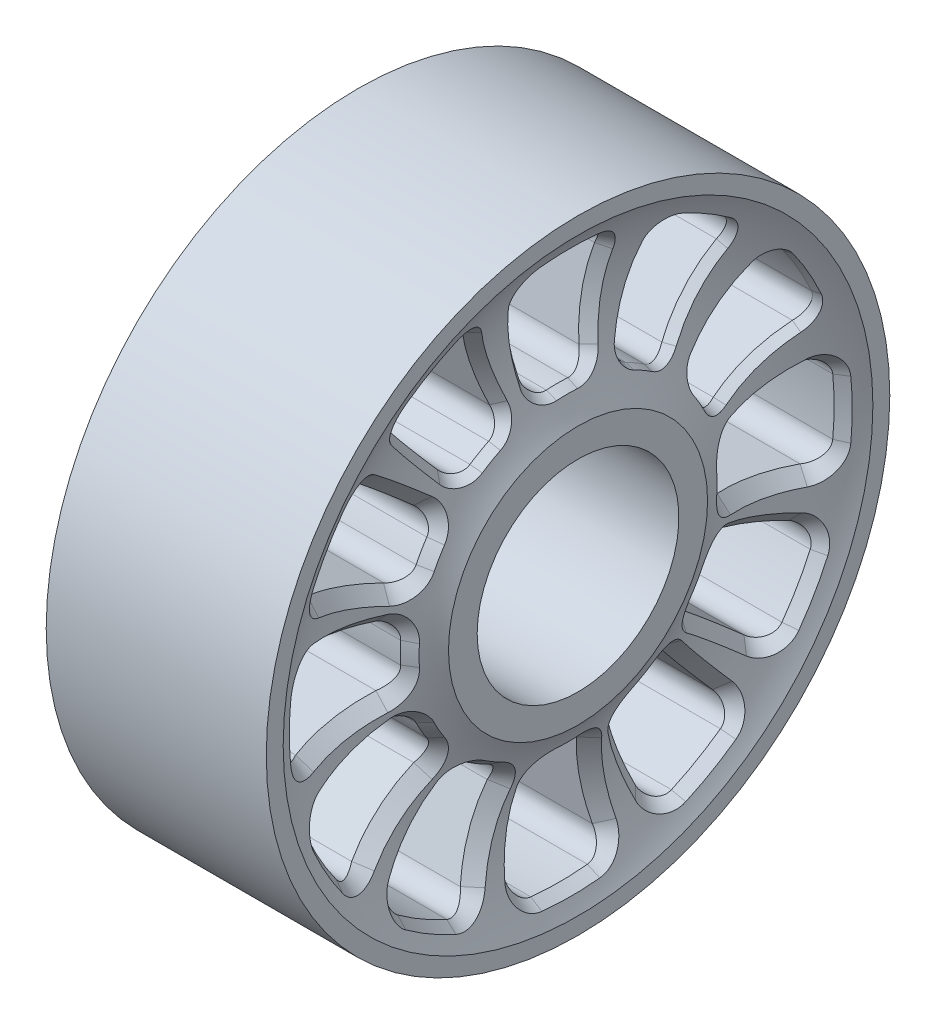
SolidWorks part; units mm, degrees
ref_plane "Alzado" through (0, 0, 0) normal (0, 0, 1) x (1, 0, 0)
ref_plane "Planta" through (0, 0, 0) normal (0, 1, 0) x (1, 0, 0)
ref_plane "Vista lateral" through (0, 0, 0) normal (1, 0, 0) x (0, 0, -1)
sketch "Croquis1" plane through (0, 0, 0) normal (0, 0, 1) x (1, 0, 0)
  line L0 (0, 0) -> (0, 11) construction
  line L1 (0, 11) -> (24, 11)
  line L2 (0, 11) -> (0, 16)
  line L3 (0, 16) -> (24, 16)
  line L4 (24, 11) -> (24, 16)
  line L5 (0, 34) -> (24, 34)
  line L6 (0, 34) -> (0, 31)
  line L7 (0, 31) -> (24, 31)
  line L8 (24, 34) -> (24, 31)
  line L9 (0, 16) -> (0, 31) construction
  line L10 (0, 0) -> (24, 0) construction
  line L11 (24, 0) -> (24, 11) construction
  dimension "D1" = 11
  dimension "D2" = 5
  dimension "D3" = 34
  dimension "D4" = 3
  dimension "D5" = 24
revolve "Revolución1" add sketch "Croquis1" angle 360 about L10
sketch "Croquis2" plane through (24, 0, 0) normal (1, 0, 0) x (0, 0, -1)
  line L0 (-5.2094, 29.5442) -> (-2.952, 16.7417)
  line L1 (2.952, 16.7417) -> (5.2094, 29.5442)
  line L2 (0, 30) -> (0, 31) construction
  line L3 (10.9274, 13.0228) -> (19.2836, 22.9813)
  line L4 (10.2606, 28.1908) -> (5.8143, 15.9748)
  line L5 (15.9748, 5.8143) -> (28.1908, 10.2606)
  line L6 (22.9813, 19.2836) -> (13.0228, 10.9274)
  line L7 (16.7417, -2.952) -> (29.5442, -5.2094)
  line L8 (29.5442, 5.2094) -> (16.7417, 2.952)
  line L9 (13.0228, -10.9274) -> (22.9813, -19.2836)
  line L10 (28.1908, -10.2606) -> (15.9748, -5.8143)
  line L11 (5.8143, -15.9748) -> (10.2606, -28.1908)
  line L12 (19.2836, -22.9813) -> (10.9274, -13.0228)
  line L13 (-2.952, -16.7417) -> (-5.2094, -29.5442)
  line L14 (5.2094, -29.5442) -> (2.952, -16.7417)
  line L15 (-10.9274, -13.0228) -> (-19.2836, -22.9813)
  line L16 (-10.2606, -28.1908) -> (-5.8143, -15.9748)
  line L17 (-15.9748, -5.8143) -> (-28.1908, -10.2606)
  line L18 (-22.9813, -19.2836) -> (-13.0228, -10.9274)
  line L19 (-16.7417, 2.952) -> (-29.5442, 5.2094)
  line L20 (-29.5442, -5.2094) -> (-16.7417, -2.952)
  line L21 (-13.0228, 10.9274) -> (-22.9813, 19.2836)
  line L22 (-28.1908, 10.2606) -> (-15.9748, 5.8143)
  line L23 (-5.8143, 15.9748) -> (-10.2606, 28.1908)
  line L24 (-19.2836, 22.9813) -> (-10.9274, 13.0228)
  arc A0 (-2.952, 16.7417) -> (2.952, 16.7417) centre (0, 0) cw
  arc A1 (5.2094, 29.5442) -> (-5.2094, 29.5442) centre (0, 0) ccw
  circle A2 centre (0, 0) radius 16 construction
  circle A3 centre (0, 0) radius 31 construction
  arc A4 (19.2836, 22.9813) -> (10.2606, 28.1908) centre (0, 0) ccw
  arc A5 (5.8143, 15.9748) -> (10.9274, 13.0228) centre (0, 0) cw
  arc A6 (28.1908, 10.2606) -> (22.9813, 19.2836) centre (0, 0) ccw
  arc A7 (13.0228, 10.9274) -> (15.9748, 5.8143) centre (0, 0) cw
  arc A8 (29.5442, -5.2094) -> (29.5442, 5.2094) centre (0, 0) ccw
  arc A9 (16.7417, 2.952) -> (16.7417, -2.952) centre (0, 0) cw
  arc A10 (22.9813, -19.2836) -> (28.1908, -10.2606) centre (0, 0) ccw
  arc A11 (15.9748, -5.8143) -> (13.0228, -10.9274) centre (0, 0) cw
  arc A12 (10.2606, -28.1908) -> (19.2836, -22.9813) centre (0, 0) ccw
  arc A13 (10.9274, -13.0228) -> (5.8143, -15.9748) centre (0, 0) cw
  arc A14 (-5.2094, -29.5442) -> (5.2094, -29.5442) centre (0, 0) ccw
  arc A15 (2.952, -16.7417) -> (-2.952, -16.7417) centre (0, 0) cw
  arc A16 (-19.2836, -22.9813) -> (-10.2606, -28.1908) centre (0, 0) ccw
  arc A17 (-5.8143, -15.9748) -> (-10.9274, -13.0228) centre (0, 0) cw
  arc A18 (-28.1908, -10.2606) -> (-22.9813, -19.2836) centre (0, 0) ccw
  arc A19 (-13.0228, -10.9274) -> (-15.9748, -5.8143) centre (0, 0) cw
  arc A20 (-29.5442, 5.2094) -> (-29.5442, -5.2094) centre (0, 0) ccw
  arc A21 (-16.7417, -2.952) -> (-16.7417, 2.952) centre (0, 0) cw
  arc A22 (-22.9813, 19.2836) -> (-28.1908, 10.2606) centre (0, 0) ccw
  arc A23 (-15.9748, 5.8143) -> (-13.0228, 10.9274) centre (0, 0) cw
  arc A24 (-10.2606, 28.1908) -> (-19.2836, 22.9813) centre (0, 0) ccw
  arc A25 (-10.9274, 13.0228) -> (-5.8143, 15.9748) centre (0, 0) cw
  circle A26 centre (0, 0) radius 16
  circle A27 centre (0, 0) radius 31
  point P12 (0, 17)
  point P59 (0, 0)
  dimension "D1" = 1
  dimension "D2" = 1
  dimension "D3" = 20
  dimension "D4" = 12
extrude "Saliente-Extruir1" add sketch "Croquis2" against normal through all
sketch "Croquis3" plane through (0, 0, 0) normal (0, 0, 1) x (1, 0, 0)
  line L0 (0, 16.7417) -> (0, 29.5442) construction
  line L1 (0, 0) -> (24, 0) construction
  line L2 (24, -11) -> (24, 11) construction
  line L3 (12, 0) -> (12, 34) construction
  line L4 (24, 34) -> (0, 34) construction
  circle A0 centre (-15, 23.143) radius 17.5
  circle A1 centre (39, 23.143) radius 17.5
  point P5 (0, 23.143)
  dimension "D2" = 35
  dimension "D1" = 15
revolve "Cortar-Revolución1" cut sketch "Croquis3" angle 360 about L1
fillet "Redondeo1" radius 2 48 edges at (12, 19.2836, 22.9813) (12, -5.2094, -29.5442) (12, 5.2094, -29.5442) (12, 10.2606, -28.1908) (12, 19.2836, -22.9813) (12, 22.9813, -19.2836) (12, 28.1908, -10.2606) (12, 29.5442, -5.2094) (12, 29.5442, 5.2094) (12, 28.1908, 10.2606) (12, 22.9813, 19.2836) (12, 5.2094, 29.5442) (12, -5.2094, 29.5442) (12, -10.2606, 28.1908) (12, -19.2836, 22.9813) (12, -22.9813, 19.2836) (12, -28.1908, 10.2606) (12, -29.5442, 5.2094) (12, -29.5442, -5.2094) (12, -28.1908, -10.2606) (12, -22.9813, -19.2836) (12, -19.2836, -22.9813) (12, -10.2606, -28.1908) (12, -5.8143, -15.9748) (12, -10.9274, 13.0228) (12, -15.9748, 5.8143) (12, -16.7417, -2.952) (12, -13.0228, -10.9274) (12, -15.9748, -5.8143) (12, -16.7417, 2.952) (12, -13.0228, 10.9274) (12, -5.8143, 15.9748) (12, -2.952, 16.7417) (12, 2.952, 16.7417) (12, 5.8143, 15.9748) (12, 13.0228, 10.9274) (12, 16.7417, 2.952) (12, 15.9748, -5.8143) (12, 10.9274, -13.0228) (12, 2.952, -16.7417) (12, -10.9274, -13.0228) (12, -2.952, -16.7417) (12, 5.8143, -15.9748) (12, 13.0228, -10.9274) (12, 16.7417, -2.952) (12, 15.9748, 5.8143) (12, 10.9274, 13.0228) (12, 10.2606, 28.1908)
chamfer "Chaflán1" distance 1 angle 30 192 edges at (22.8993, 0, -30) (22.7481, -4.2266, -29.3304) (22.5914, 4.6066, -28.8611) (21.5022, -4.067, -23.0651) (21.5022, 4.067, -23.0651) (22.3957, -2.598, -17.4235) (22.459, 2.3827, -17.2658) (22.6136, 0, -17) (22.8993, -15, -25.9808) (22.7481, -18.3255, -23.2876) (22.5914, -10.4412, -27.2977) (21.5022, -15.0547, -17.9414) (21.5022, -8.0104, -22.0084) (22.3957, -10.9617, -13.7902) (22.459, -6.5694, -16.144) (22.6136, -8.5, -14.7224) (22.8993, -25.9808, -15) (22.7481, -27.5141, -11.0049) (22.5914, -22.6912, -18.42) (21.5022, -22.0084, -8.0104) (21.5022, -17.9414, -15.0547) (22.3957, -16.3882, -6.4618) (22.459, -13.7613, -10.6964) (22.6136, -14.7224, -8.5) (22.8993, -30, 0) (22.7481, -29.3304, 4.2266) (22.5914, -28.8611, -4.6066) (21.5022, -23.0651, 4.067) (21.5022, -23.0651, -4.067) (22.3957, -17.4235, 2.598) (22.459, -17.2658, -2.3827) (22.6136, -17, 0) (22.8993, -25.9808, 15) (22.7481, -23.2876, 18.3255) (22.5914, -27.2977, 10.4412) (21.5022, -17.9414, 15.0547) (21.5022, -22.0084, 8.0104) (22.3957, -13.7902, 10.9617) (22.459, -16.144, 6.5694) (22.6136, -14.7224, 8.5) (22.8993, -15, 25.9808) (22.7481, -11.0049, 27.5141) (22.5914, -18.42, 22.6912) (21.5022, -8.0104, 22.0084) (21.5022, -15.0547, 17.9414) (22.3957, -6.4618, 16.3882) (22.459, -10.6964, 13.7613) (22.6136, -8.5, 14.7224) (22.8993, 0, 30) (22.7481, 4.2266, 29.3304) (22.5914, -4.6066, 28.8611) (21.5022, 4.067, 23.0651) (21.5022, -4.067, 23.0651) (22.3957, 2.598, 17.4235) (22.459, -2.3827, 17.2658) (22.6136, 0, 17) (22.8993, 15, 25.9808) (22.7481, 18.3255, 23.2876) (22.5914, 10.4412, 27.2977) (21.5022, 15.0547, 17.9414) (21.5022, 8.0104, 22.0084) (22.3957, 10.9617, 13.7902) (22.459, 6.5694, 16.144) (22.6136, 8.5, 14.7224) (22.5914, 22.6912, 18.42) (22.8993, 25.9808, 15) (21.5022, 17.9414, 15.0547) (22.7481, 27.5141, 11.0049) (22.459, 13.7613, 10.6964) (21.5022, 22.0084, 8.0104) (22.6136, 14.7224, 8.5) (22.3957, 16.3882, 6.4618) (22.5914, 28.8611, 4.6066) (22.8993, 30, 0) (21.5022, 23.0651, 4.067) (22.7481, 29.3304, -4.2266) (22.459, 17.2658, 2.3827) (21.5022, 23.0651, -4.067) (22.6136, 17, 0) (22.3957, 17.4235, -2.598) (21.5022, 22.0084, -8.0104) (22.5914, 27.2977, -10.4412) (22.459, 16.144, -6.5694) (22.8993, 25.9808, -15) (22.6136, 14.7224, -8.5) (22.7481, 23.2876, -18.3255) (22.3957, 13.7902, -10.9617) (21.5022, 17.9414, -15.0547) (21.5022, 15.0547, -17.9414) (22.5914, 18.42, -22.6912) (22.459, 10.6964, -13.7613) (22.8993, 15, -25.9808) (22.6136, 8.5, -14.7224) (22.7481, 11.0049, -27.5141) (22.3957, 6.4618, -16.3882) (21.5022, 8.0104, -22.0084) (1.1007, 25.9808, -15) (1.2519, 27.5141, -11.0049) (1.4086, 22.6912, -18.42) (2.4978, 22.0084, -8.0104) (2.4978, 17.9414, -15.0547) (1.6043, 16.3882, -6.4618) (1.541, 13.7613, -10.6964) (1.3864, 14.7224, -8.5) (1.1007, 15, -25.9808) (1.2519, 18.3255, -23.2876) (1.4086, 10.4412, -27.2977) (2.4978, 15.0547, -17.9414) (2.4978, 8.0104, -22.0084) (1.6043, 10.9617, -13.7902) (1.541, 6.5694, -16.144) (1.3864, 8.5, -14.7224) (1.1007, 0, -30) (1.2519, 4.2266, -29.3304) (1.4086, -4.6066, -28.8611) (2.4978, 4.067, -23.0651) (2.4978, -4.067, -23.0651) (1.6043, 2.598, -17.4235) (1.541, -2.3827, -17.2658) (1.3864, 0, -17) (1.1007, -15, -25.9808) (1.2519, -11.0049, -27.5141) (1.4086, -18.42, -22.6912) (2.4978, -8.0104, -22.0084) (2.4978, -15.0547, -17.9414) (1.6043, -6.4618, -16.3882) (1.541, -10.6964, -13.7613) (1.3864, -8.5, -14.7224) (1.1007, -25.9808, -15) (1.2519, -23.2876, -18.3255) (1.4086, -27.2977, -10.4412) (2.4978, -17.9414, -15.0547) (2.4978, -22.0084, -8.0104) (1.6043, -13.7902, -10.9617) (1.541, -16.144, -6.5694) (1.3864, -14.7224, -8.5) (1.1007, -30, 0) (1.2519, -29.3304, -4.2266) (1.4086, -28.8611, 4.6066) (2.4978, -23.0651, -4.067) (2.4978, -23.0651, 4.067) (1.6043, -17.4235, -2.598) (1.541, -17.2658, 2.3827) (1.3864, -17, 0) (1.2519, -27.5141, 11.0049) (2.4978, -22.0084, 8.0104) (1.1007, -25.9808, 15) (1.6043, -16.3882, 6.4618) (1.4086, -22.6912, 18.42) (1.3864, -14.7224, 8.5) (2.4978, -17.9414, 15.0547) (1.541, -13.7613, 10.6964) (1.2519, -18.3255, 23.2876) (2.4978, -15.0547, 17.9414) (1.1007, -15, 25.9808) (1.6043, -10.9617, 13.7902) (1.4086, -10.4412, 27.2977) (1.3864, -8.5, 14.7224) (2.4978, -8.0104, 22.0084) (1.541, -6.5694, 16.144) (2.4978, -4.067, 23.0651) (1.6043, -2.598, 17.4235) (1.2519, -4.2266, 29.3304) (1.3864, 0, 17) (1.1007, 0, 30) (1.541, 2.3827, 17.2658) (1.4086, 4.6066, 28.8611) (2.4978, 4.067, 23.0651) (2.4978, 8.0104, 22.0084) (1.6043, 6.4618, 16.3882) (1.2519, 11.0049, 27.5141) (1.3864, 8.5, 14.7224) (1.1007, 15, 25.9808) (1.541, 10.6964, 13.7613) (1.4086, 18.42, 22.6912) (2.4978, 15.0547, 17.9414) (2.4978, 22.0084, 8.0104) (1.4086, 27.2977, 10.4412) (1.541, 16.144, 6.5694) (1.1007, 25.9808, 15) (1.3864, 14.7224, 8.5) (1.2519, 23.2876, 18.3255) (1.6043, 13.7902, 10.9617) (2.4978, 17.9414, 15.0547) (2.4978, 23.0651, -4.067) (1.4086, 28.8611, -4.6066) (1.541, 17.2658, -2.3827) (1.1007, 30, 0) (1.3864, 17, 0) (1.2519, 29.3304, 4.2266) (1.6043, 17.4235, 2.598) (2.4978, 23.0651, 4.067)
